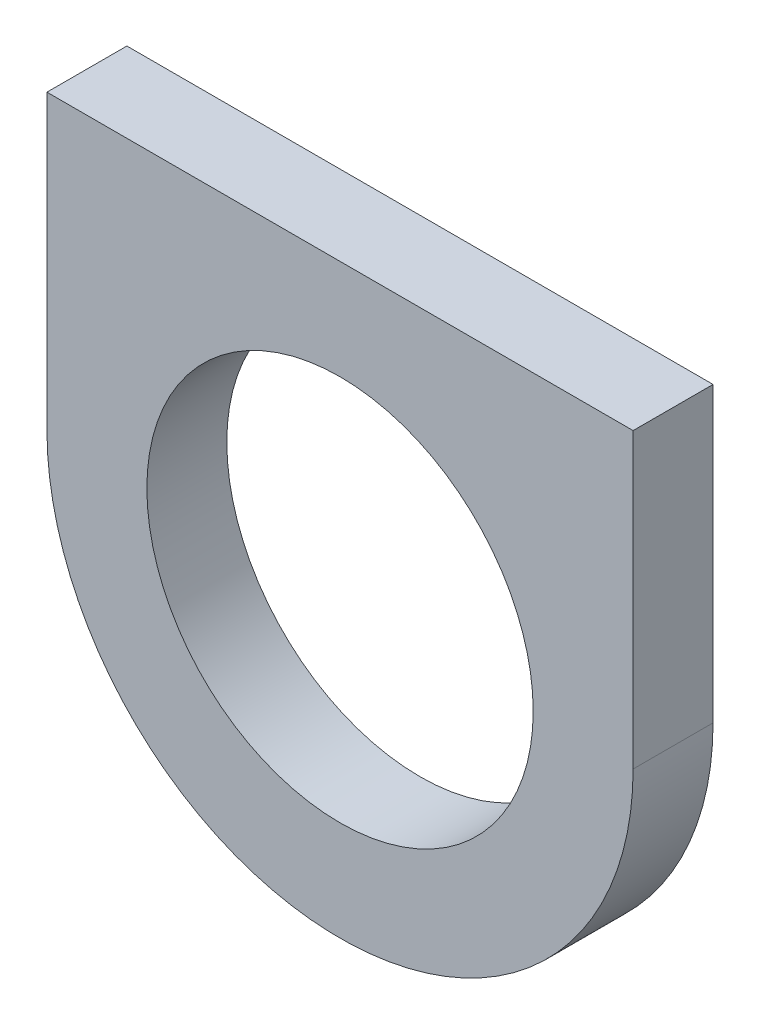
SolidWorks part; units mm, degrees
ref_plane "Plan de face" through (0, 0, 0) normal (0, 0, 1) x (1, 0, 0)
ref_plane "Plan de dessus" through (0, 0, 0) normal (0, 1, 0) x (1, 0, 0)
ref_plane "Plan de droite" through (0, 0, 0) normal (1, 0, 0) x (0, 0, -1)
sketch "Esquisse1" plane through (0, 0, 0) normal (0, 0, 1) x (1, 0, 0)
  line L0 (110, 0) -> (110, 110)
  line L1 (110, 110) -> (-110, 110)
  line L2 (-110, 110) -> (-110, 0)
  arc A0 (-110, 0) -> (110, 0) centre (0, 0) ccw
  circle A1 centre (0, 0) radius 72.5
  dimension "D1" = 145
  dimension "D2" = 110
  dimension "D3" = 110
  dimension "D4" = 220
extrude "Extrusion1" add sketch "Esquisse1" along normal blind 30
